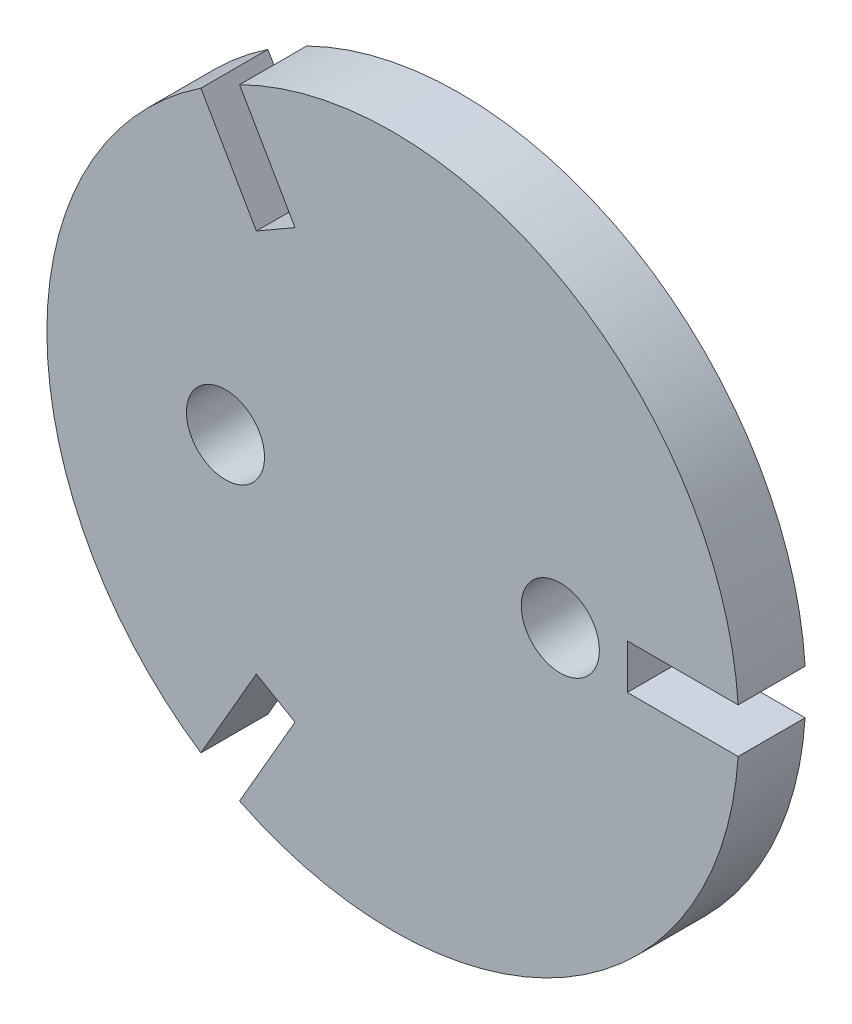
SolidWorks part; units mm, degrees
ref_plane "Plan de face" through (0, 0, 0) normal (0, 0, 1) x (1, 0, 0)
ref_plane "Plan de dessus" through (0, 0, 0) normal (0, 1, 0) x (1, 0, 0)
ref_plane "Plan de droite" through (0, 0, 0) normal (1, 0, 0) x (0, 0, -1)
sketch "Esquisse1" plane through (0, 0, 0) normal (0, 0, 1) x (1, 0, 0)
  line L0 (0, 0) -> (15.5, 0) construction
  line L1 (0, 0) -> (-15.5, 0) construction
  line L2 (0, 0) -> (-7.75, 13.4234) construction
  line L3 (0, 0) -> (-7.75, -13.4234) construction
  circle A0 centre (0, 0) radius 15.5
  circle A1 centre (7.5, 0) radius 1.75
  circle A2 centre (-7.5, 0) radius 1.75
  dimension "D1" = 31
  dimension "D4" = 7.5
  dimension "D5" = 7.5
  dimension "D6" = 3.5
  dimension "D7" = 3.5
  dimension "D2" = 120
  dimension "D3" = 120
extrude "Boss.-Extru.1" add sketch "Esquisse1" along normal blind 3
sketch "Esquisse2" plane through (0, 0, 3) normal (0, 0, 1) x (1, 0, 0)
  line L0 (0, 0) -> (15.5, 0) construction
  line L1 (-7.2405, -14.5409) -> (-4.384, -9.5933)
  line L2 (16.213, -1) -> (10.5, -1)
  line L3 (16.213, -1) -> (16.213, 1)
  line L4 (16.213, 1) -> (10.5, 1)
  line L5 (10.5, -1) -> (10.5, 1)
  line L6 (-8.9725, -13.5409) -> (-6.116, -8.5933)
  line L7 (-6.116, -8.5933) -> (-4.384, -9.5933)
  line L8 (-8.9725, 13.5409) -> (-6.116, 8.5933)
  line L9 (-7.2405, 14.5409) -> (-4.384, 9.5933)
  line L10 (-4.384, 9.5933) -> (-6.116, 8.5933)
  line L11 (-8.9725, -13.5409) -> (-7.2405, -14.5409)
  line L12 (-7.2405, 14.5409) -> (-8.9725, 13.5409)
  circle A0 centre (0, 0) radius 15.5 construction
  point P21 (0, 0)
  point P25 (0, 0)
  dimension "D1" = 10.5
  dimension "D2" = 1
  dimension "D3" = 1
  dimension "D4" = 3
  dimension "D5" = 3
extrude "Enlèv. mat.-Extru.1" cut sketch "Esquisse2" against normal blind 3
